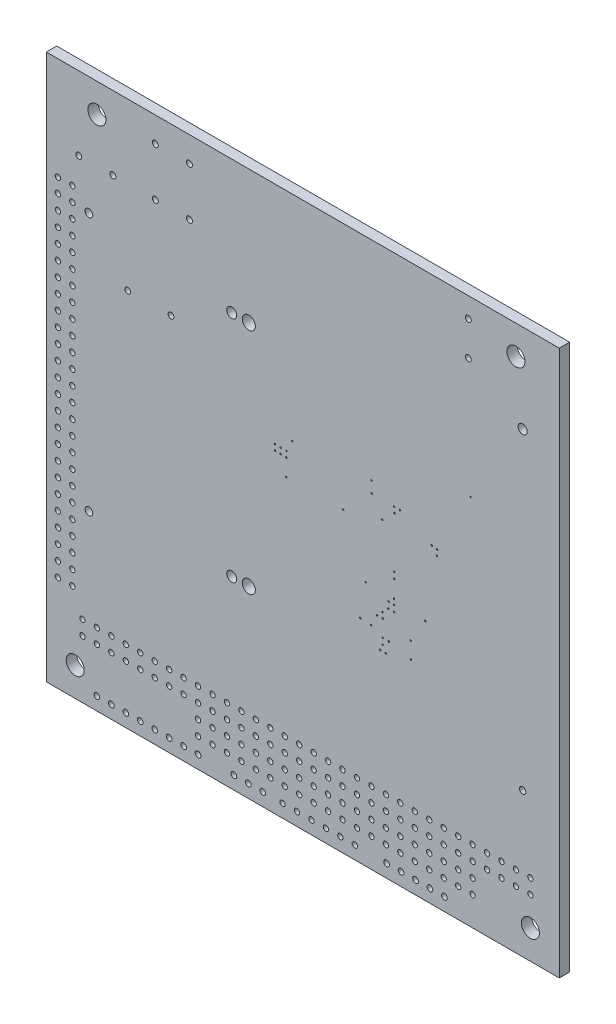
SolidWorks part; units mm, degrees
ref_plane "Front Plane" through (0, 0, 0) normal (0, 0, 1) x (1, 0, 0)
ref_plane "Top Plane" through (0, 0, 0) normal (0, 1, 0) x (1, 0, 0)
ref_plane "Right Plane" through (0, 0, 0) normal (1, 0, 0) x (0, 0, -1)
imported_body "Imported1"
sketch "Sketch1" plane through (0, 0, 1.9863) normal (0, 0, 1) x (1, 0, 0)
  line L1 (12.7, 108.585) -> (102.87, 108.585)
  line L2 (12.7, 108.585) -> (12.7, 12.7)
  line L3 (12.7, 12.7) -> (102.87, 12.7)
  line L4 (102.87, 108.585) -> (102.87, 12.7)
extrude "Cut-Extrude1" cut sketch "Sketch1" against normal offset from surface (0.1575 mm away) 1.8288
